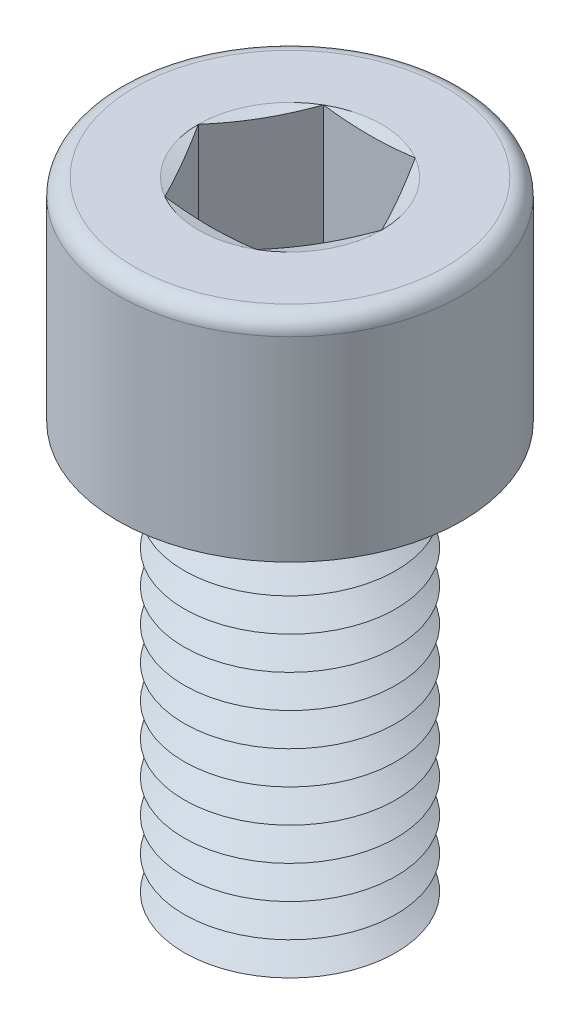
SolidWorks part; units mm, degrees
ref_plane "Front Plane" through (0, 0, 0) normal (0, 0, 1) x (1, 0, 0)
ref_plane "Top Plane" through (0, 0, 0) normal (0, 1, 0) x (1, 0, 0)
ref_plane "Right Plane" through (0, 0, 0) normal (1, 0, 0) x (0, 0, -1)
sketch "Sketch1" plane through (0, 0, 0) normal (0, 1, 0) x (1, 0, 0)
  circle A0 centre (0, 0) radius 4
  dimension "D1" = 8
extrude "Extrude1" add sketch "Sketch1" along normal blind 16
sketch "Sketch2" plane through (0, 16, 0) normal (0, 1, 0) x (1, 0, 0)
  circle A0 centre (0, 0) radius 6.5
  dimension "D1" = 13
extrude "Extrude2" add sketch "Sketch2" along normal blind 8
sketch "Sketch3" plane through (0, 24, 0) normal (0, 1, 0) x (1, 0, 0)
  line L1 (1.7321, 3) -> (-1.7321, 3)
  line L2 (-1.7321, 3) -> (-3.4641, 0)
  line L3 (-3.4641, 0) -> (-1.7321, -3)
  line L4 (-1.7321, -3) -> (1.7321, -3)
  line L5 (1.7321, -3) -> (3.4641, 0)
  line L6 (3.4641, 0) -> (1.7321, 3)
  circle A0 centre (0, 0) radius 3 construction
  dimension "D1" = 6
extrude "Extrude3" cut sketch "Sketch3" against normal blind 6
fillet "Fillet1" radius 0.625 1 edges at (0, 24, 6.5)
sketch "Sketch4" plane through (0, 0, 0) normal (1, 0, 0) x (0, 0, -1)
  line L0 (-3, 18) -> (0, 18)
  line L1 (0, 18) -> (0, 16.2679)
  line L2 (0, 16.2679) -> (-3, 18)
  dimension "D1" = 30
revolve "Cut-Revolve1" cut sketch "Sketch4" angle 360 about L1
sketch "Sketch5" plane through (0, 0, 0) normal (0, 0, 1) x (1, 0, 0)
  line L0 (-4, 0.625) -> (-4, -0.625)
  line L1 (-4, 16) -> (-4, 0) construction
  line L2 (-4, -0.625) -> (-2.9175, 0)
  line L3 (-4, 0) -> (4, 0) construction
  line L4 (-2.9175, 0) -> (-4, 0.625)
  dimension "D1" = 1.25
revolve "Cut-Revolve2" cut sketch "Sketch5" angle 360 about axis through (0, 16, 0) along (0, -1, 0)
pattern_linear "LPattern1" count 13 spacing 1.25 along (0, 1, 0) of "Cut-Revolve2"
sketch "Sketch6" plane through (0, 24, 0) normal (0, 1, 0) x (1, 0, 0)
  circle A0 centre (0, 0) radius 3.4641
extrude "Extrude4" cut sketch "Sketch6" against normal through all draft 75
